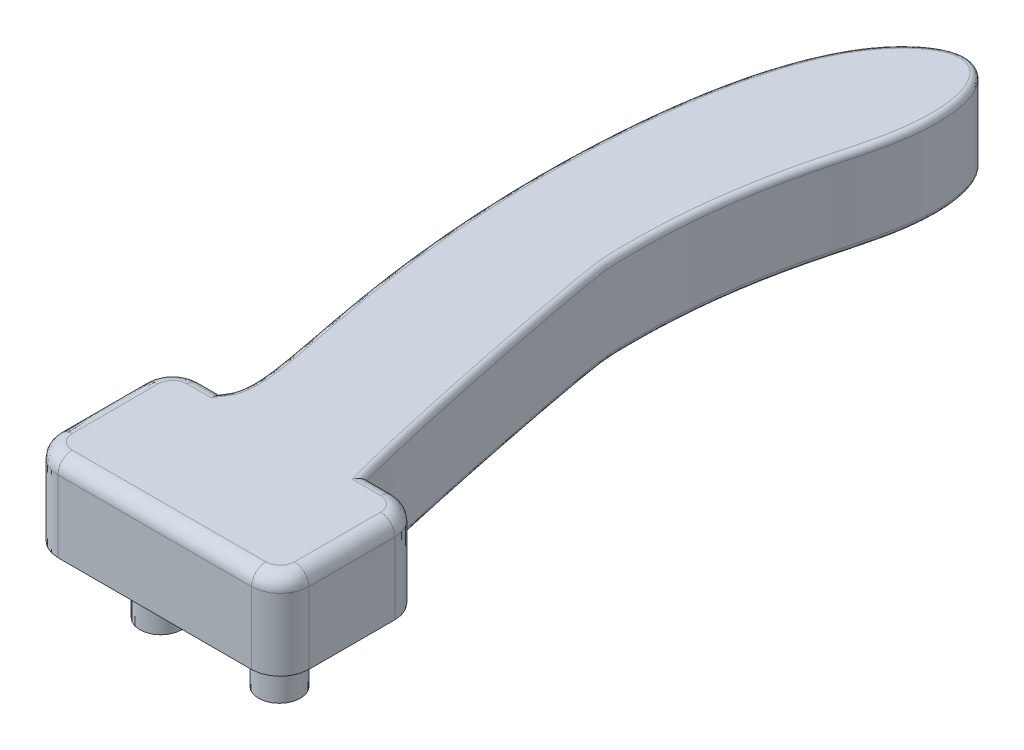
SolidWorks part; units mm, degrees
ref_plane "Front Plane" through (0, 0, 0) normal (0, 0, 1) x (1, 0, 0)
ref_plane "Top Plane" through (0, 0, 0) normal (0, 1, 0) x (1, 0, 0)
ref_plane "Right Plane" through (0, 0, 0) normal (1, 0, 0) x (0, 0, -1)
sketch "Sketch1" plane through (0, 0, 0) normal (0, 1, 0) x (1, 0, 0)
  line L0 (0, 0) -> (22.225, 0)
  line L1 (22.225, 0) -> (22.225, 12.7)
  line L2 (22.225, 12.7) -> (17.3484, 12.7)
  line L3 (0, 0) -> (0, 12.7)
  line L4 (0, 12.7) -> (4.8766, 12.7)
  spline S1 degree 3 poles (17.3484, 12.7) (15.8234, 15.1811) (21.7921, 28.8043) (19.8681, 63.9739) (9.326, 73.7826) (5.3503, 67.7417) (10.33, 50.7287) (10.5024, 43.3748) (10.39, 37.9408) (6.2268, 17.5406) (4.8766, 12.7) knots 0.019374 0.019374 0.019374 0.019374 0.303985 0.516151 0.559533 0.717996 0.756053 0.902049 0.92675 0.98481 0.98481 0.98481 0.98481
  dimension "D1" = 22.225
  dimension "D2" = 12.7
extrude "Boss-Extrude1" add sketch "Sketch1" along normal blind 7.62
fillet "Fillet1" radius 2.54 4 edges at (0, 3.81, -12.7) (0, 3.81, 0) (22.225, 3.81, 0) (22.225, 3.81, -12.7)
fillet "Fillet10" radius 1.27 9 edges at (0.7439, 7.62, -0.7439) (0, 7.62, -6.35) (3.7083, 7.62, -12.7) (0.7439, 7.62, -11.9561) (18.5167, 7.62, -12.7) (21.4811, 7.62, -11.9561) (22.225, 7.62, -6.35) (21.4811, 7.62, -0.7439) (11.1125, 7.62, 0)
sketch "Sketch2" plane through (0, 0, 0) normal (0, -1, 0) x (1, 0, 0)
  line L0 (11.1125, -5.7969) -> (16.3671, -5.7969) construction
  line L3 (2.54, 0) -> (19.685, 0) construction
  line L4 (11.1125, -5.7969) -> (11.1125, 0) construction
  line L6 (5.8579, -5.7969) -> (11.1125, -5.7969) construction
  circle A0 centre (5.8579, -5.7969) radius 1.8574
  circle A1 centre (16.3671, -5.7969) radius 1.8574
  point P4 (4.0005, -5.7969)
  point P5 (18.2245, -5.7969)
  point P16 (11.1125, 0)
  point P17 (11.1125, -5.7969)
  dimension "D2" = 3.7147
  dimension "D1" = 14.224
extrude "Boss-Extrude2" add sketch "Sketch2" along normal blind 5.842
ref_plane "Plane1" through (-7.62, 0, 0) normal (-1, 0, 0) x (0, 0, 1)
fillet "Fillet11" radius 0.508 2 edges
mirror "Mirror5" about plane through (-7.62, 0, 0) normal (-1, 0, 0)
delete or keep bodies "Body-Delete/Keep 1" type delete bodies bodies 102
